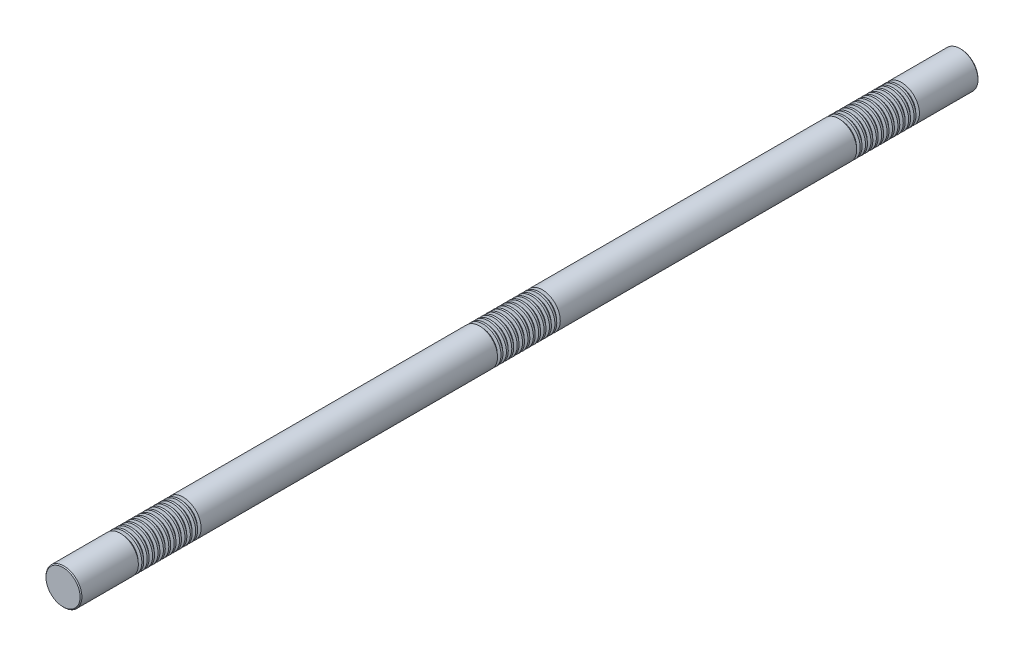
SolidWorks part; units mm, degrees
ref_plane "Front Plane" through (0, 0, 0) normal (0, 0, 1) x (1, 0, 0)
ref_plane "Top Plane" through (0, 0, 0) normal (0, 1, 0) x (1, 0, 0)
ref_plane "Right Plane" through (0, 0, 0) normal (1, 0, 0) x (0, 0, -1)
sketch "Sketch1" plane through (0, 0, 0) normal (0, 0, 1) x (1, 0, 0)
  circle A0 centre (0, 0) radius 30
  dimension "D1" = 60
extrude "Boss-Extrude1" add sketch "Sketch1" along normal mid plane 1500
chamfer "Chamfer1" distance 1.5 angle 45 2 edges at (30, 0, -750) (30, 0, 750)
sketch "Sketch2" plane through (0, 0, 0) normal (1, 0, 0) x (0, 0, -1)
  line L0 (650.6699, 30) -> (644.8301, 30)
  line L1 (748.5, 30) -> (-748.5, 30) construction
  line L2 (644.8301, 30) -> (646.1699, 25)
  line L3 (646.1699, 25) -> (649.3301, 25)
  line L4 (649.3301, 25) -> (650.6699, 30)
  line L5 (750, -28.5) -> (750, 28.5) construction
  point P4 (647.75, 30)
  point P7 (647.75, 25)
  point P8 (650, 27.5)
  point P9 (645.5, 27.5)
  dimension "D1" = 4.5
  dimension "D2" = 100
  dimension "D3" = 5
  dimension "D4" = 30
revolve "Cut-Revolve1" cut sketch "Sketch2" angle 360 about axis through (0, 0, 750) along (0, 0, -1)
pattern_linear "LPattern1" count 12 spacing 9 along (0, 0, 1) of "Cut-Revolve1"
pattern_linear "LPattern2" count 3 spacing 600 along (0, 0, 1) of "Cut-Revolve1", "LPattern1"
